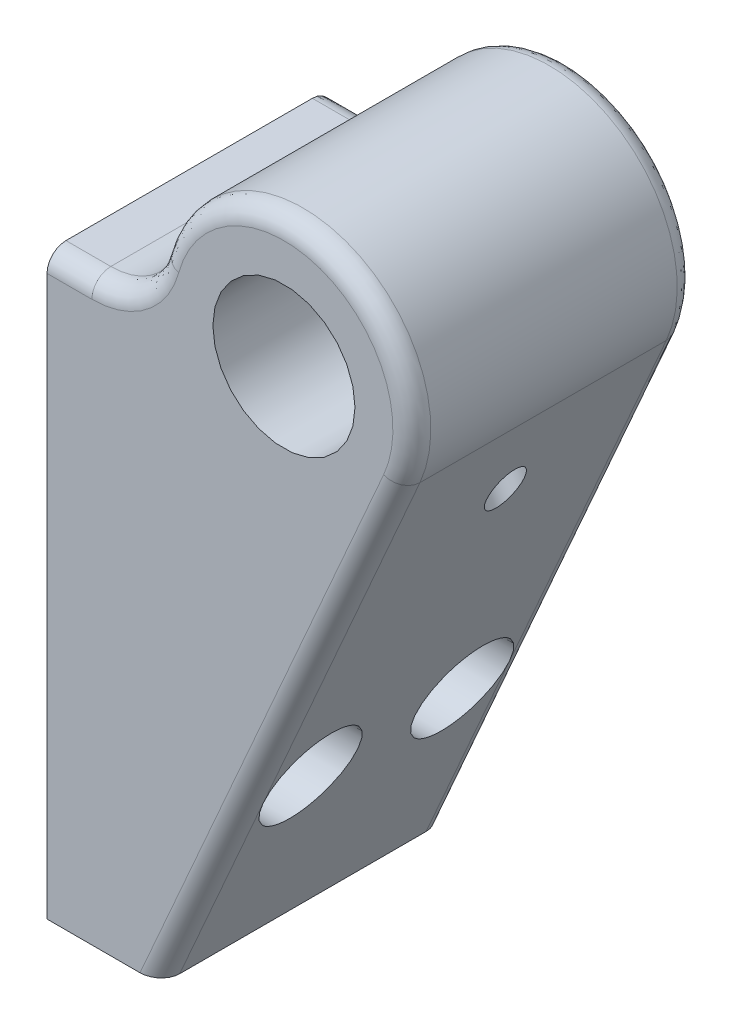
SolidWorks part; units mm, degrees
ref_plane "Plan de face" through (0, 0, 0) normal (0, 0, 1) x (1, 0, 0)
ref_plane "Plan de dessus" through (0, 0, 0) normal (0, 1, 0) x (1, 0, 0)
ref_plane "Plan de droite" through (0, 0, 0) normal (1, 0, 0) x (0, 0, -1)
sketch "Esquisse2" plane through (0, 0, 0) normal (0, 0, 1) x (1, 0, 0)
  line L0 (-25, -2) -> (-25, -63)
  line L1 (-25, -63) -> (-13, -63)
  line L2 (-13, -63) -> (12.3545, -5.4422)
  line L3 (-25, -2) -> (-20.267, -2)
  circle A0 centre (0, 0) radius 7.5
  arc A1 (12.3545, -5.4422) -> (-13.0288, 3.5357) centre (0, 0) ccw
  arc A2 (-20.267, -2) -> (-13.0288, 3.5357) centre (-20.267, 5.5) ccw
extrude "Boss.-Extru.1" add sketch "Esquisse2" along normal mid plane 30
sketch "Esquisse1" plane through (0, 0, 0) normal (0, 0, 1) x (1, 0, 0)
  line L2 (0, 0) -> (-3.4702, 6.0105) construction
  line L8 (11.7762, -16.397) -> (4.5252, -3.8379)
  line L9 (4.5252, -3.8379) -> (2.7932, -4.8379)
  line L10 (2.7932, -4.8379) -> (10.0441, -17.397)
  line L11 (10.0441, -17.397) -> (11.7762, -16.397)
  dimension "D3" = 4
fillet "Congé1" radius 2 8 edges at (-0.3228, -34.2211, -15) (4.5016, 12.7274, -15) (-15.7108, -0.4574, -15) (-0.3228, -34.2211, 15) (-22.6335, -2, 15) (-15.7108, -0.4574, 15) (-22.6335, -2, -15) (4.5016, 12.7274, 15)
revolve "Enlèvement de matière-Révolution1" cut sketch "Esquisse1" angle 360 about L2
ref_plane "Plan1" through (-15, 0, 0) normal (-1, 0, 0) x (0, 0, 1)
sketch "Esquisse3" plane through (-15, 0, 0) normal (-1, 0, 0) x (0, 0, 1)
  circle A0 centre (-8, -43) radius 3.25
  circle A1 centre (8, -43) radius 3.25
  dimension "D2" = 6.5
  dimension "D3" = 16
  dimension "D4" = 8
  dimension "D1" = 43
extrude "Enlèv. mat.-Extru.1" cut sketch "Esquisse3" along normal blind 30
sketch "Esquisse4" plane through (-15, 0, 0) normal (-1, 0, 0) x (0, 0, 1)
  circle A0 centre (-8, -43) radius 5
  circle A1 centre (8, -43) radius 5
  dimension "D1" = 10
extrude "Enlèv. mat.-Extru.2" cut sketch "Esquisse4" against normal blind 30
